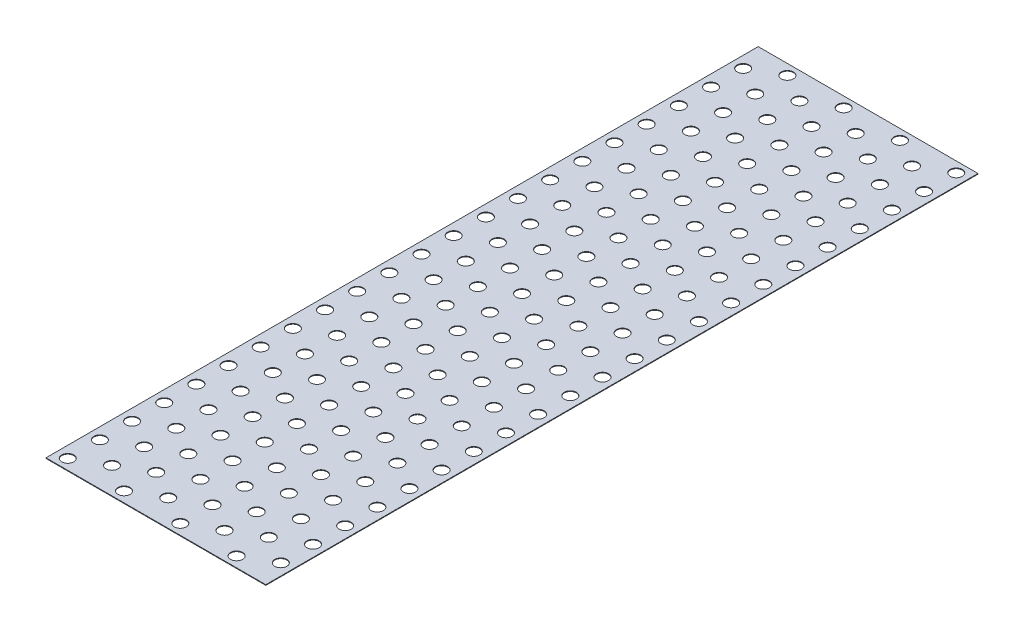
SolidWorks part; units mm, degrees
ref_plane "Alzado" through (0, 0, 0) normal (0, 0, 1) x (1, 0, 0)
ref_plane "Planta" through (0, 0, 0) normal (0, 1, 0) x (1, 0, 0)
ref_plane "Vista lateral" through (0, 0, 0) normal (1, 0, 0) x (0, 0, -1)
sketch "Croquis1" plane through (0, 0, 0) normal (0, 1, 0) x (1, 0, 0)
  line L1 (0, 0) -> (173.575, 0)
  line L2 (0, 0) -> (0, 562.452)
  line L3 (0, 562.452) -> (173.575, 562.452)
  line L4 (173.575, 0) -> (173.575, 562.452)
  dimension "D1" = 562.452
  dimension "D2" = 173.575
extrude "Saliente-Extruir1" add sketch "Croquis1" along normal blind 0.5
sketch "Croquis2" plane through (0, 0.5, 0) normal (0, 1, 0) x (1, 0, 0)
  circle A0 centre (9, 541.576) radius 4.7625
  circle A1 centre (53.45, 541.576) radius 4.7625
  circle A2 centre (97.9, 541.576) radius 4.7625
  circle A3 centre (142.35, 541.576) radius 4.7625
  circle A4 centre (9, 516.176) radius 4.7625
  circle A5 centre (53.45, 516.176) radius 4.7625
  circle A6 centre (97.9, 516.176) radius 4.7625
  circle A7 centre (142.35, 516.176) radius 4.7625
  circle A8 centre (9, 490.776) radius 4.7625
  circle A9 centre (53.45, 490.776) radius 4.7625
  circle A10 centre (97.9, 490.776) radius 4.7625
  circle A11 centre (142.35, 490.776) radius 4.7625
  circle A12 centre (9, 465.376) radius 4.7625
  circle A13 centre (53.45, 465.376) radius 4.7625
  circle A14 centre (97.9, 465.376) radius 4.7625
  circle A15 centre (142.35, 465.376) radius 4.7625
  circle A16 centre (9, 439.976) radius 4.7625
  circle A17 centre (53.45, 439.976) radius 4.7625
  circle A18 centre (97.9, 439.976) radius 4.7625
  circle A19 centre (142.35, 439.976) radius 4.7625
  circle A20 centre (9, 414.576) radius 4.7625
  circle A21 centre (53.45, 414.576) radius 4.7625
  circle A22 centre (97.9, 414.576) radius 4.7625
  circle A23 centre (142.35, 414.576) radius 4.7625
  circle A24 centre (9, 389.176) radius 4.7625
  circle A25 centre (53.45, 389.176) radius 4.7625
  circle A26 centre (97.9, 389.176) radius 4.7625
  circle A27 centre (142.35, 389.176) radius 4.7625
  circle A28 centre (9, 363.776) radius 4.7625
  circle A29 centre (53.45, 363.776) radius 4.7625
  circle A30 centre (97.9, 363.776) radius 4.7625
  circle A31 centre (142.35, 363.776) radius 4.7625
  circle A32 centre (9, 338.376) radius 4.7625
  circle A33 centre (53.45, 338.376) radius 4.7625
  circle A34 centre (97.9, 338.376) radius 4.7625
  circle A35 centre (142.35, 338.376) radius 4.7625
  circle A36 centre (9, 312.976) radius 4.7625
  circle A37 centre (53.45, 312.976) radius 4.7625
  circle A38 centre (97.9, 312.976) radius 4.7625
  circle A39 centre (142.35, 312.976) radius 4.7625
  circle A40 centre (9, 287.576) radius 4.7625
  circle A41 centre (53.45, 287.576) radius 4.7625
  circle A42 centre (97.9, 287.576) radius 4.7625
  circle A43 centre (142.35, 287.576) radius 4.7625
  circle A44 centre (9, 262.176) radius 4.7625
  circle A45 centre (53.45, 262.176) radius 4.7625
  circle A46 centre (97.9, 262.176) radius 4.7625
  circle A47 centre (142.35, 262.176) radius 4.7625
  circle A48 centre (9, 236.776) radius 4.7625
  circle A49 centre (53.45, 236.776) radius 4.7625
  circle A50 centre (97.9, 236.776) radius 4.7625
  circle A51 centre (142.35, 236.776) radius 4.7625
  circle A52 centre (9, 211.376) radius 4.7625
  circle A53 centre (53.45, 211.376) radius 4.7625
  circle A54 centre (97.9, 211.376) radius 4.7625
  circle A55 centre (142.35, 211.376) radius 4.7625
  circle A56 centre (9, 185.976) radius 4.7625
  circle A57 centre (53.45, 185.976) radius 4.7625
  circle A58 centre (97.9, 185.976) radius 4.7625
  circle A59 centre (142.35, 185.976) radius 4.7625
  circle A60 centre (9, 160.576) radius 4.7625
  circle A61 centre (53.45, 160.576) radius 4.7625
  circle A62 centre (97.9, 160.576) radius 4.7625
  circle A63 centre (142.35, 160.576) radius 4.7625
  circle A64 centre (9, 135.176) radius 4.7625
  circle A65 centre (53.45, 135.176) radius 4.7625
  circle A66 centre (97.9, 135.176) radius 4.7625
  circle A67 centre (142.35, 135.176) radius 4.7625
  circle A68 centre (9, 109.776) radius 4.7625
  circle A69 centre (53.45, 109.776) radius 4.7625
  circle A70 centre (97.9, 109.776) radius 4.7625
  circle A71 centre (142.35, 109.776) radius 4.7625
  circle A72 centre (9, 84.376) radius 4.7625
  circle A73 centre (53.45, 84.376) radius 4.7625
  circle A74 centre (97.9, 84.376) radius 4.7625
  circle A75 centre (142.35, 84.376) radius 4.7625
  circle A76 centre (9, 58.976) radius 4.7625
  circle A77 centre (53.45, 58.976) radius 4.7625
  circle A78 centre (97.9, 58.976) radius 4.7625
  circle A79 centre (142.35, 58.976) radius 4.7625
  circle A80 centre (9, 33.576) radius 4.7625
  circle A81 centre (53.45, 33.576) radius 4.7625
  circle A82 centre (97.9, 33.576) radius 4.7625
  circle A83 centre (142.35, 33.576) radius 4.7625
  circle A84 centre (9, 8.176) radius 4.7625
  circle A85 centre (53.45, 8.176) radius 4.7625
  circle A86 centre (97.9, 8.176) radius 4.7625
  circle A87 centre (142.35, 8.176) radius 4.7625
  circle A88 centre (31.225, 554.276) radius 4.7625
  circle A89 centre (75.675, 554.276) radius 4.7625
  circle A90 centre (120.125, 554.276) radius 4.7625
  circle A91 centre (164.575, 554.276) radius 4.7625
  circle A92 centre (31.225, 528.876) radius 4.7625
  circle A93 centre (75.675, 528.876) radius 4.7625
  circle A94 centre (120.125, 528.876) radius 4.7625
  circle A95 centre (164.575, 528.876) radius 4.7625
  circle A96 centre (31.225, 503.476) radius 4.7625
  circle A97 centre (75.675, 503.476) radius 4.7625
  circle A98 centre (120.125, 503.476) radius 4.7625
  circle A99 centre (164.575, 503.476) radius 4.7625
  circle A100 centre (31.225, 478.076) radius 4.7625
  circle A101 centre (75.675, 478.076) radius 4.7625
  circle A102 centre (120.125, 478.076) radius 4.7625
  circle A103 centre (164.575, 478.076) radius 4.7625
  circle A104 centre (31.225, 452.676) radius 4.7625
  circle A105 centre (75.675, 452.676) radius 4.7625
  circle A106 centre (120.125, 452.676) radius 4.7625
  circle A107 centre (164.575, 452.676) radius 4.7625
  circle A108 centre (31.225, 427.276) radius 4.7625
  circle A109 centre (75.675, 427.276) radius 4.7625
  circle A110 centre (120.125, 427.276) radius 4.7625
  circle A111 centre (164.575, 427.276) radius 4.7625
  circle A112 centre (31.225, 401.876) radius 4.7625
  circle A113 centre (75.675, 401.876) radius 4.7625
  circle A114 centre (120.125, 401.876) radius 4.7625
  circle A115 centre (164.575, 401.876) radius 4.7625
  circle A116 centre (31.225, 376.476) radius 4.7625
  circle A117 centre (75.675, 376.476) radius 4.7625
  circle A118 centre (120.125, 376.476) radius 4.7625
  circle A119 centre (164.575, 376.476) radius 4.7625
  circle A120 centre (31.225, 351.076) radius 4.7625
  circle A121 centre (75.675, 351.076) radius 4.7625
  circle A122 centre (120.125, 351.076) radius 4.7625
  circle A123 centre (164.575, 351.076) radius 4.7625
  circle A124 centre (31.225, 325.676) radius 4.7625
  circle A125 centre (75.675, 325.676) radius 4.7625
  circle A126 centre (120.125, 325.676) radius 4.7625
  circle A127 centre (164.575, 325.676) radius 4.7625
  circle A128 centre (31.225, 300.276) radius 4.7625
  circle A129 centre (75.675, 300.276) radius 4.7625
  circle A130 centre (120.125, 300.276) radius 4.7625
  circle A131 centre (164.575, 300.276) radius 4.7625
  circle A132 centre (31.225, 274.876) radius 4.7625
  circle A133 centre (75.675, 274.876) radius 4.7625
  circle A134 centre (120.125, 274.876) radius 4.7625
  circle A135 centre (164.575, 274.876) radius 4.7625
  circle A136 centre (31.225, 249.476) radius 4.7625
  circle A137 centre (75.675, 249.476) radius 4.7625
  circle A138 centre (120.125, 249.476) radius 4.7625
  circle A139 centre (164.575, 249.476) radius 4.7625
  circle A140 centre (31.225, 224.076) radius 4.7625
  circle A141 centre (75.675, 224.076) radius 4.7625
  circle A142 centre (120.125, 224.076) radius 4.7625
  circle A143 centre (164.575, 224.076) radius 4.7625
  circle A144 centre (31.225, 198.676) radius 4.7625
  circle A145 centre (75.675, 198.676) radius 4.7625
  circle A146 centre (120.125, 198.676) radius 4.7625
  circle A147 centre (164.575, 198.676) radius 4.7625
  circle A148 centre (31.225, 173.276) radius 4.7625
  circle A149 centre (75.675, 173.276) radius 4.7625
  circle A150 centre (120.125, 173.276) radius 4.7625
  circle A151 centre (164.575, 173.276) radius 4.7625
  circle A152 centre (31.225, 147.876) radius 4.7625
  circle A153 centre (75.675, 147.876) radius 4.7625
  circle A154 centre (120.125, 147.876) radius 4.7625
  circle A155 centre (164.575, 147.876) radius 4.7625
  circle A156 centre (31.225, 122.476) radius 4.7625
  circle A157 centre (75.675, 122.476) radius 4.7625
  circle A158 centre (120.125, 122.476) radius 4.7625
  circle A159 centre (164.575, 122.476) radius 4.7625
  circle A160 centre (31.225, 97.076) radius 4.7625
  circle A161 centre (75.675, 97.076) radius 4.7625
  circle A162 centre (120.125, 97.076) radius 4.7625
  circle A163 centre (164.575, 97.076) radius 4.7625
  circle A164 centre (31.225, 71.676) radius 4.7625
  circle A165 centre (75.675, 71.676) radius 4.7625
  circle A166 centre (120.125, 71.676) radius 4.7625
  circle A167 centre (164.575, 71.676) radius 4.7625
  circle A168 centre (31.225, 46.276) radius 4.7625
  circle A169 centre (75.675, 46.276) radius 4.7625
  circle A170 centre (120.125, 46.276) radius 4.7625
  circle A171 centre (164.575, 46.276) radius 4.7625
  circle A172 centre (31.225, 20.876) radius 4.7625
  circle A173 centre (75.675, 20.876) radius 4.7625
  circle A174 centre (120.125, 20.876) radius 4.7625
  circle A175 centre (164.575, 20.876) radius 4.7625
  dimension "D1" = 9.525
  dimension "D6" = 9.525
  dimension "D2" = 20.876
  dimension "D3" = 9
  dimension "D7" = 22.225
  dimension "D8" = 12.7
  dimension "D11" = 8.176
  dimension "D12" = 8.176
  dimension "D4" = 4
  dimension "D5" = 22
  dimension "D9" = 4
  dimension "D10" = 22
extrude "Cortar-Extruir1" cut sketch "Croquis2" against normal blind 0.5
